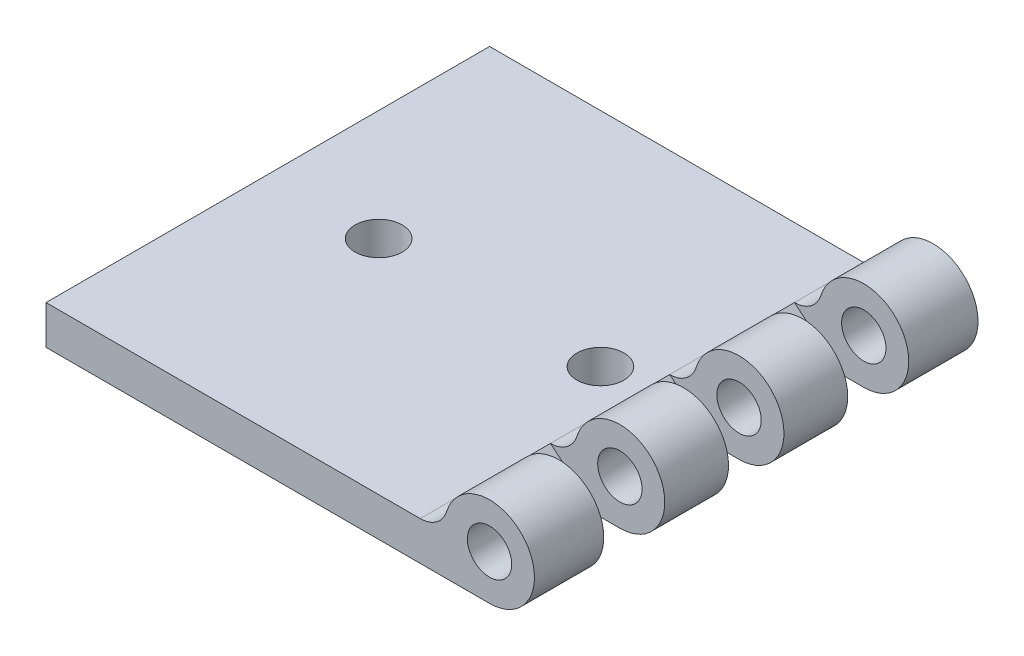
SolidWorks part; units mm, degrees
ref_plane "Ebene vorne" through (0, 0, 0) normal (0, 0, 1) x (1, 0, 0)
ref_plane "Ebene oben" through (0, 0, 0) normal (0, 1, 0) x (1, 0, 0)
ref_plane "Ebene rechts" through (0, 0, 0) normal (1, 0, 0) x (0, 0, -1)
sketch "Skizze1" plane through (0, 0, 0) normal (0, 0, 1) x (1, 0, 0)
  line L0 (0, 0) -> (-80, 0)
  line L1 (-80, 0) -> (-80, 7)
  line L2 (-80, 7) -> (-12.506, 7)
  arc A0 (0, 0) -> (-7.7327, 10.5115) centre (0, 8.1) ccw
  arc A1 (-7.7327, 10.5115) -> (-12.506, 7) centre (-12.506, 12) cw
  circle A2 centre (0, 8.1) radius 4
  point P9 (0, 0)
  dimension "D2" = 8.1
  dimension "D3" = 5
  dimension "D4" = 8
  dimension "D1" = 7
  dimension "D5" = 80
extrude "Linear austragen1" add sketch "Skizze1" along normal blind 80
ref_plane "Ebene1" through (-10.7856, 9.0502, 0) normal (0.766, -0.6428, 0) x (0, 0, 1)
sketch "Skizze2" plane through (-10.7856, 9.0502, 0) normal (0.766, -0.6428, 0) x (0, 0, 1)
  line L0 (80, 2.6764) -> (0, 2.6764) construction
  line L1 (67.5, 2.6764) -> (56.5, 2.6764)
  line L2 (67.5, 2.6764) -> (67.5, -24.0694)
  line L3 (67.5, -24.0694) -> (56.5, -24.0694)
  line L4 (56.5, 2.6764) -> (56.5, -24.0694)
  line L5 (80, -14.305) -> (80, 0) construction
  line L6 (45, 2.6764) -> (35, 2.6764)
  line L7 (45, 2.6764) -> (45, -24.0694)
  line L8 (45, -24.0694) -> (35, -24.0694)
  line L9 (35, 2.6764) -> (35, -24.0694)
  line L10 (23.5, 2.6764) -> (12.5, 2.6764)
  line L11 (23.5, 2.6764) -> (23.5, -27.82)
  line L12 (23.5, -27.82) -> (12.5, -27.82)
  line L13 (12.5, 2.6764) -> (12.5, -27.82)
  line L14 (0, 0) -> (0, -14.305) construction
  line L15 (80, -10.205) -> (80, -2.205) construction
  dimension "D1" = 12.5
  dimension "D2" = 12.5
  dimension "D3" = 35
  dimension "D4" = 35
  dimension "D5" = 11
  dimension "D6" = 11
extrude "Schnitt-Linear austragen1" cut sketch "Skizze2" along normal through all
sketch "Skizze3" plane through (0, 7, 0) normal (0, 1, 0) x (1, 0, 0)
  line L0 (0, -35) -> (0, -23.5) construction
  line L1 (-80, -40) -> (-4.1637, -40) construction
  line L2 (-80, -80) -> (-80, 0) construction
  line L3 (-4.1637, -45) -> (-4.1637, -35) construction
  circle A0 centre (-60, -40) radius 4.25
  circle A1 centre (-20, -40) radius 4.25
  point P0 (-20, -40)
  point P1 (-60, -40)
  dimension "D3" = 8.5
  dimension "D1" = 20
  dimension "D2" = 40
extrude "Schnitt-Linear austragen2" cut sketch "Skizze3" against normal through all
